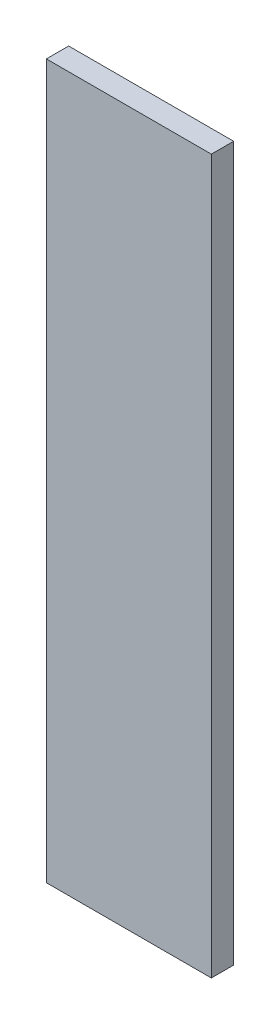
SolidWorks part; units mm, degrees
ref_plane "Front Plane" through (0, 0, 0) normal (0, 0, 1) x (1, 0, 0)
ref_plane "Top Plane" through (0, 0, 0) normal (0, 1, 0) x (1, 0, 0)
ref_plane "Right Plane" through (0, 0, 0) normal (1, 0, 0) x (0, 0, -1)
sketch "Sketch1" plane through (0, 0, 0) normal (0, 0, 1) x (1, 0, 0)
  line L1 (-37, 75) -> (0, 75)
  line L2 (-37, 75) -> (-37, -85)
  line L3 (-37, -85) -> (0, -85)
  line L4 (0, 75) -> (0, -85)
  line L5 (-37, 75) -> (0, -85) construction
  line L6 (-37, -85) -> (0, 75) construction
  point P0 (-18.5, -5)
  dimension "D1" = 160
  dimension "D2" = 37
extrude "Boss-Extrude1" add sketch "Sketch1" along normal blind 5
